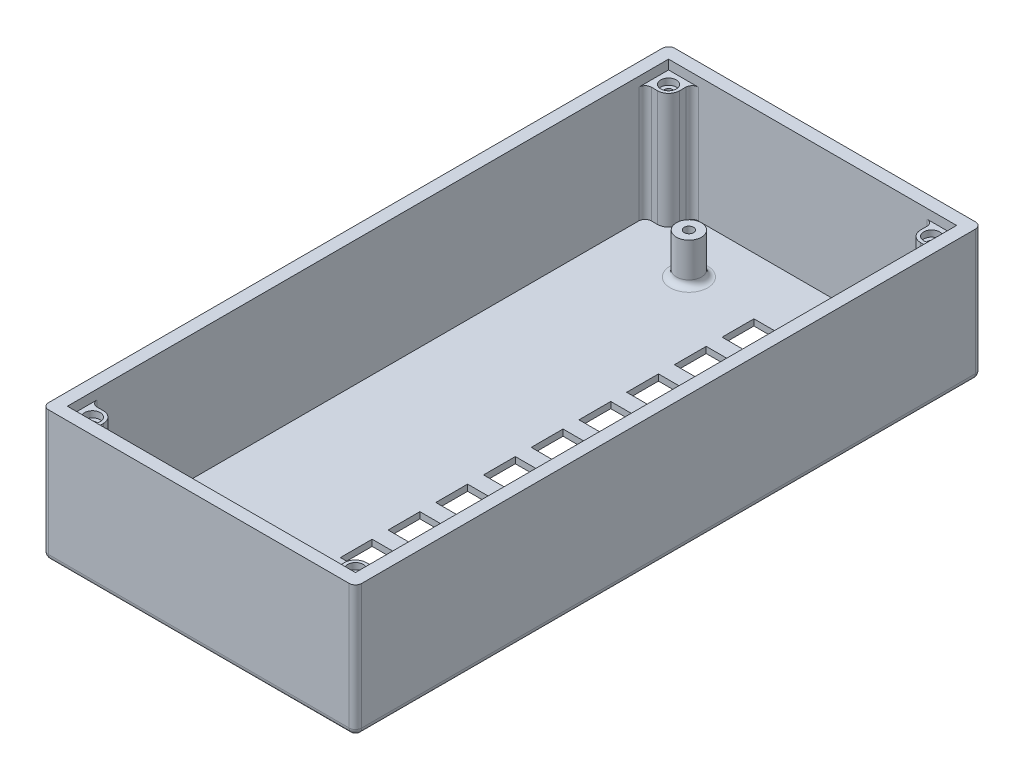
SolidWorks part; units mm, degrees
ref_plane "Front Plane" through (0, 0, 0) normal (0, 0, 1) x (1, 0, 0)
ref_plane "Top Plane" through (0, 0, 0) normal (0, 1, 0) x (1, 0, 0)
ref_plane "Right Plane" through (0, 0, 0) normal (1, 0, 0) x (0, 0, -1)
sketch "Sketch1" plane through (0, 0, 0) normal (0, 1, 0) x (1, 0, 0)
  line L1 (50, -100) -> (-50, -100)
  line L2 (50, -100) -> (50, 100)
  line L3 (50, 100) -> (-50, 100)
  line L4 (-50, -100) -> (-50, 100)
  line L5 (50, -100) -> (-50, 100) construction
  line L6 (50, 100) -> (-50, -100) construction
  point P0 (0, 0)
  dimension "D1" = 200
  dimension "D2" = 100
extrude "Boss-Extrude1" add sketch "Sketch1" along normal blind 2
sketch "Sketch3" plane through (0, 2, 0) normal (0, 1, 0) x (1, 0, 0)
  line L1 (-50, 100) -> (50, 100)
  line L2 (-50, 100) -> (-50, -100)
  line L3 (-50, -100) -> (50, -100)
  line L4 (50, 100) -> (50, -100)
  line L5 (-46, 96) -> (-46, -96)
  line L6 (-46, -96) -> (46, -96)
  line L7 (46, 96) -> (46, -96)
  line L8 (-46, 96) -> (46, 96)
  point P25 (-50, 100)
  dimension "D1" = 4
extrude "Boss-Extrude2" add sketch "Sketch3" along normal blind 40
sketch "Sketch16" plane through (0, 2, 0) normal (0, 1, 0) x (1, 0, 0)
  line L0 (46, 96) -> (-46, 96) construction
  line L1 (-46, -96) -> (46, -96) construction
  line L2 (-46, 96) -> (-46, -96) construction
  line L3 (-46, 96) -> (-46, -96) construction
  line L4 (46, 96) -> (-46, 96) construction
  line L8 (46, -96) -> (46, 96) construction
  line L9 (-46, -96) -> (46, -96) construction
  line L11 (46, -96) -> (46, 96) construction
  circle A4 centre (-42, 92) radius 3.5
  circle A5 centre (42, 92) radius 3.5
  circle A6 centre (42, -92) radius 3.5
  circle A7 centre (-42, -92) radius 3.5
  dimension "D1" = 4
  dimension "D2" = 4
  dimension "D4" = 4
  dimension "D7" = 7
  dimension "D3" = 4
  dimension "D5" = 4
  dimension "D6" = 4
  dimension "D8" = 4
  dimension "D9" = 4
extrude "Boss-Extrude3" add sketch "Sketch16" along normal blind 37
fillet "Fillet2" radius 2 4 edges at (50, 0, 0) (0, 0, 100) (-50, 0, 0) (0, 0, -100)
sketch "Sketch43" plane through (0, 2, 0) normal (0, 1, 0) x (1, 0, 0)
  line L0 (-42, 88.5) -> (-38.5, 92)
  line L1 (-38.5, 92) -> (-38.5, 96)
  line L2 (46, 96) -> (-46, 96) construction
  line L3 (-38.5, 96) -> (-46, 96)
  line L4 (-46, 96) -> (-46, 88.5)
  line L5 (-46, 96) -> (-46, -96) construction
  line L6 (-46, 88.5) -> (-42, 88.5)
  line L7 (38.5, 92) -> (38.5, 96)
  line L8 (46, 96) -> (-46, 96) construction
  line L9 (38.5, 96) -> (46, 96)
  line L10 (46, -96) -> (46, 96) construction
  line L11 (46, 96) -> (46, 88.5)
  line L12 (46, 88.5) -> (42, 88.5)
  line L13 (42, 88.5) -> (38.5, 92)
  line L14 (38.5, -92) -> (42, -88.5)
  line L15 (42, -88.5) -> (46, -88.5)
  line L16 (46, -96) -> (46, 96) construction
  line L17 (46, -88.5) -> (46, -96)
  line L18 (46, -96) -> (38.5, -96)
  line L19 (-46, -96) -> (46, -96) construction
  line L20 (38.5, -96) -> (38.5, -92)
  line L21 (-42, -88.5) -> (-46, -88.5)
  line L22 (-46, 96) -> (-46, -96) construction
  line L23 (-46, -88.5) -> (-46, -96)
  line L24 (-46, -96) -> (-38.5, -96)
  line L25 (-38.5, -96) -> (-38.5, -92)
  line L26 (-38.5, -92) -> (-42, -88.5)
  circle A0 centre (-42, 92) radius 3.5 construction
  circle A1 centre (-42, 92) radius 3.5 construction
  circle A2 centre (42, 92) radius 3.5 construction
  circle A3 centre (42, 92) radius 3.5 construction
  circle A4 centre (42, -92) radius 3.5 construction
  circle A5 centre (42, -92) radius 3.5 construction
  circle A6 centre (-42, -92) radius 3.5 construction
  circle A7 centre (-42, -92) radius 3.5 construction
  dimension "D1" = 4
  dimension "D2" = 4
  dimension "D3" = 4
  dimension "D4" = 4
extrude "Boss-Extrude16" add sketch "Sketch43" along normal blind 37
fillet "Fillet5" radius 2 8 edges at (49.4142, 0.5858, -99.4142) (50, 22, -100) (49.4142, 0.5858, 99.4142) (-49.4142, 0.5858, 99.4142) (-49.4142, 0.5858, -99.4142) (50, 22, 100) (-50, 22, 100) (-50, 22, -100)
sketch "Sketch44" plane through (0, 39, 0) normal (0, 1, 0) x (1, 0, 0)
  circle A0 centre (-42, 92) radius 2.5
  circle A1 centre (42, 92) radius 2.5
  circle A2 centre (42, -92) radius 2.5
  circle A3 centre (-42, -92) radius 2.5
  dimension "D1" = 5
  dimension "D2" = 5
  dimension "D3" = 5
  dimension "D4" = 5
extrude "Cut-Extrude10" cut sketch "Sketch44" against normal blind 2
sketch "Sketch45" plane through (0, 37, 0) normal (0, 1, 0) x (1, 0, 0)
  circle A0 centre (-42, 92) radius 1.25
  circle A1 centre (42, 92) radius 1.25
  circle A2 centre (42, -92) radius 1.25
  circle A3 centre (-42, -92) radius 1.25
  dimension "D1" = 2.5
  dimension "D2" = 2.5
  dimension "D3" = 2.5
  dimension "D4" = 2.5
extrude "Cut-Extrude11" cut sketch "Sketch45" against normal blind 9
fillet "Fillet6" radius 2 8 edges at (-38.5, 20.5, -96) (-46, 20.5, -88.5) (-46, 20.5, 88.5) (-38.5, 20.5, 96) (38.5, 20.5, 96) (46, 20.5, 88.5) (38.5, 20.5, -96) (46, 20.5, -88.5)
sketch "Sketch36" plane through (0, 2, 0) normal (0, 1, 0) x (1, 0, 0)
  line L0 (48, 100) -> (-48, 100) construction
  line L1 (-26, 82.5) -> (30, 82.5) construction
  line L2 (-26, 82.5) -> (-26, -78.5) construction
  line L3 (-26, -78.5) -> (30, -78.5) construction
  line L4 (30, 82.5) -> (30, -78.5) construction
  line L5 (-26, 82.5) -> (30, -78.5) construction
  line L6 (-26, -78.5) -> (30, 82.5) construction
  line L7 (50, -98) -> (50, 98) construction
  line L9 (-0.65, -59.14) -> (24.75, -59.14)
  line L10 (-0.65, -59.14) -> (-0.65, -69.3)
  line L11 (-0.65, -69.3) -> (24.75, -69.3)
  line L12 (24.75, -59.14) -> (24.75, -69.3)
  line L13 (-0.55, -44.11) -> (24.85, -44.11)
  line L14 (-0.55, -44.11) -> (-0.55, -54.27)
  line L15 (-0.55, -54.27) -> (24.85, -54.27)
  line L16 (24.85, -44.11) -> (24.85, -54.27)
  line L21 (-0.55, 1.61) -> (24.85, 1.61)
  line L22 (-0.55, 1.61) -> (-0.55, -8.55)
  line L23 (-0.55, -8.55) -> (24.85, -8.55)
  line L24 (24.85, 1.61) -> (24.85, -8.55)
  line L25 (-0.55, 16.85) -> (24.85, 16.85)
  line L26 (-0.55, 16.85) -> (-0.55, 6.69)
  line L27 (-0.55, 6.69) -> (24.85, 6.69)
  line L28 (24.85, 16.85) -> (24.85, 6.69)
  line L29 (-0.55, 32.09) -> (24.85, 32.09)
  line L30 (-0.55, 32.09) -> (-0.55, 21.93)
  line L31 (-0.55, 21.93) -> (24.85, 21.93)
  line L32 (24.85, 32.09) -> (24.85, 21.93)
  line L33 (-0.55, 47.33) -> (24.85, 47.33)
  line L34 (-0.55, 47.33) -> (-0.55, 37.17)
  line L35 (-0.55, 37.17) -> (24.85, 37.17)
  line L36 (24.85, 47.33) -> (24.85, 37.17)
  line L49 (-0.55, 62.57) -> (24.85, 62.57)
  line L50 (-0.55, 62.57) -> (-0.55, 52.41)
  line L51 (-0.55, 52.41) -> (24.85, 52.41)
  line L52 (24.85, 62.57) -> (24.85, 52.41)
  line L53 (-0.55, -28.87) -> (24.85, -28.87)
  line L54 (-0.55, -13.63) -> (24.85, -13.63)
  line L55 (-0.55, -13.63) -> (-0.55, -23.79)
  line L56 (-0.55, -23.79) -> (24.85, -23.79)
  line L57 (24.85, -13.63) -> (24.85, -23.79)
  line L58 (-0.55, -28.87) -> (-0.55, -39.03)
  line L59 (-0.55, -39.03) -> (24.85, -39.03)
  line L60 (24.85, -28.87) -> (24.85, -39.03)
  line L61 (-0.55, 77.81) -> (24.85, 77.81)
  line L62 (-0.55, 77.81) -> (-0.55, 67.65)
  line L63 (-0.55, 67.65) -> (24.85, 67.65)
  line L64 (24.85, 77.81) -> (24.85, 67.65)
  point P4 (2, 2)
  point P49 (24.85, 57.49)
  dimension "D1" = 56
  dimension "D2" = 161
  dimension "D3" = 17.5
  dimension "D4" = 20
  dimension "D5" = 9.2
  dimension "D6" = 10.16
  dimension "D7" = 25.4
  dimension "D8" = 5.25
  dimension "D9" = 10.16
  dimension "D10" = 5.15
  dimension "D11" = 10.16
  dimension "D12" = 10.16
  dimension "D13" = 10.16
  dimension "D14" = 10.16
  dimension "D15" = 5.15
  dimension "D16" = 10.16
  dimension "D17" = 10.16
  dimension "D18" = 25.4
  dimension "D19" = 5.15
  dimension "D20" = 4.87
  dimension "D21" = 5.08
  dimension "D22" = 5.08
  dimension "D23" = 5.15
  dimension "D24" = 5.08
  dimension "D25" = 5.08
  dimension "D26" = 5.08
  dimension "D27" = 5.08
  dimension "D28" = 5.08
  dimension "D29" = 5.08
  dimension "D30" = 25.4
  dimension "D31" = 5.15
  dimension "D32" = 5.15
  dimension "D33" = 5.15
  dimension "D34" = 10.16
  dimension "D35" = 25.4
  dimension "D36" = 25.4
  dimension "D37" = 10.16
  dimension "D38" = 25.4
  dimension "D39" = 25.4
  dimension "D40" = 25.4
  dimension "D41" = 25.4
  dimension "D42" = 25.4
  dimension "D43" = 25.45
  dimension "D44" = 5.15
extrude "Cut-Extrude7" cut sketch "Sketch36" against normal blind 10
sketch "Sketch37" plane through (0, 2, 0) normal (0, 1, 0) x (1, 0, 0)
  line L0 (48, 100) -> (-48, 100) construction
  line L1 (-26, 82.5) -> (30, 82.5) construction
  line L2 (-26, 82.5) -> (-26, -78.5) construction
  line L3 (-26, -78.5) -> (30, -78.5) construction
  line L4 (30, 82.5) -> (30, -78.5) construction
  line L5 (50, -98) -> (50, 98) construction
  line L7 (-26, -78.5) -> (-22.5, -78.5) construction
  line L8 (-26, -78.5) -> (-26, -75) construction
  line L9 (-26, -75) -> (-22.5, -75) construction
  line L10 (-22.5, -78.5) -> (-22.5, -75) construction
  line L11 (30, -78.5) -> (26.5, -78.5) construction
  line L12 (30, -78.5) -> (30, -75) construction
  line L13 (30, -75) -> (26.5, -75) construction
  line L14 (26.5, -78.5) -> (26.5, -75) construction
  line L15 (-26, 82.5) -> (-22.5, 82.5) construction
  line L16 (-26, 82.5) -> (-26, 79) construction
  line L17 (-26, 79) -> (-22.5, 79) construction
  line L18 (-22.5, 82.5) -> (-22.5, 79) construction
  line L19 (30, 82.5) -> (28, 82.5) construction
  line L20 (30, 82.5) -> (30, 80.5) construction
  line L21 (30, 80.5) -> (28, 80.5) construction
  line L22 (28, 82.5) -> (28, 80.5) construction
  circle A0 centre (26.5, -75) radius 4
  circle A1 centre (-22.5, -75) radius 4
  circle A2 centre (-22.5, 79) radius 4
  circle A3 centre (28, 80.5) radius 2
  dimension "D13" = 8
  dimension "D14" = 8
  dimension "D15" = 8
  dimension "D16" = 4
  dimension "D1" = 17.5
  dimension "D2" = 20
  dimension "D3" = 56
  dimension "D4" = 161
  dimension "D5" = 3.5
  dimension "D6" = 3.5
  dimension "D7" = 3.5
  dimension "D8" = 3.5
  dimension "D9" = 3.5
  dimension "D10" = 3.5
  dimension "D11" = 2
  dimension "D12" = 2
extrude "Boss-Extrude15" add sketch "Sketch37" along normal blind 13
sketch "Sketch40" plane through (0, 15, 0) normal (0, 1, 0) x (1, 0, 0)
  circle A0 centre (-22.5, 79) radius 1.5
  circle A1 centre (-22.5, -75) radius 1.5
  circle A2 centre (26.5, -75) radius 1.5
  dimension "D1" = 3
  dimension "D2" = 3
  dimension "D3" = 3
extrude "Cut-Extrude9" cut sketch "Sketch40" against normal blind 13
fillet "Fillet7" radius 2 2 edges at (-22.5, 2, -75) (-22.5, 2, 79)
